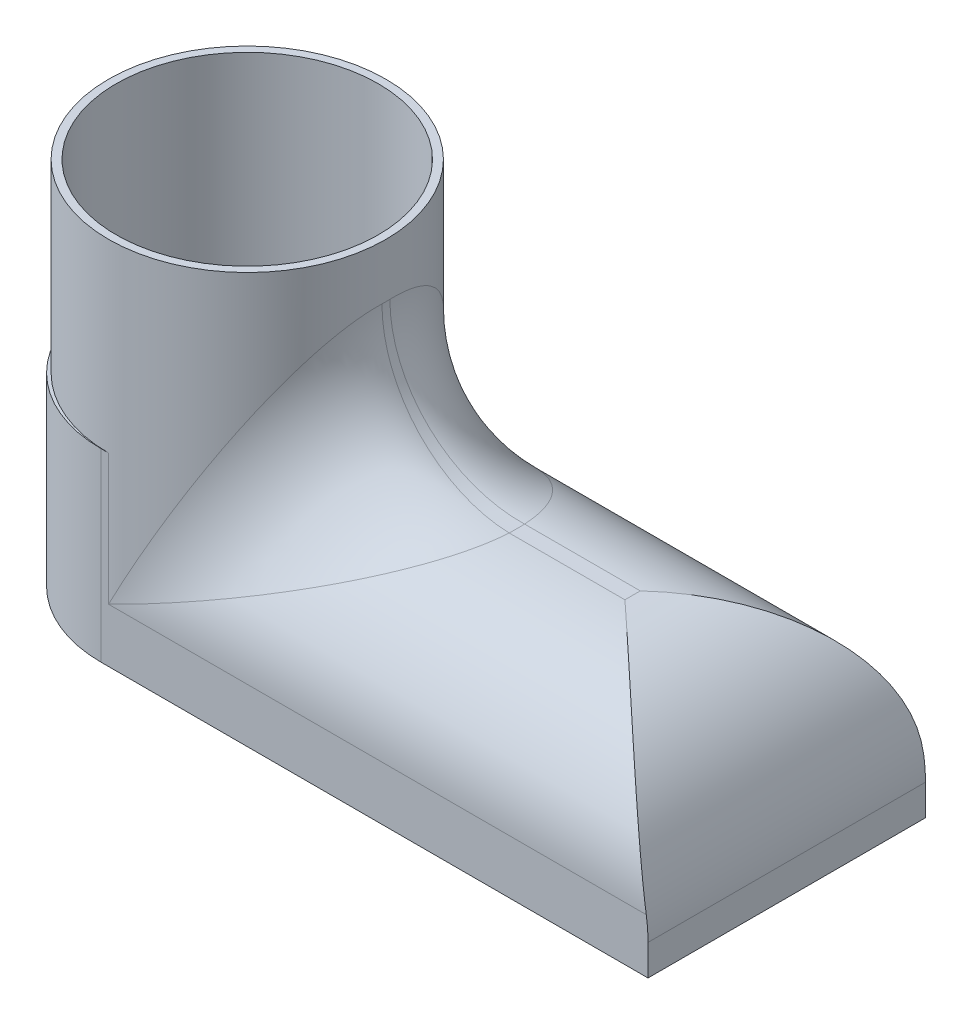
SolidWorks part; units mm, degrees
ref_plane "Front Plane" through (0, 0, 0) normal (0, 0, 1) x (1, 0, 0)
ref_plane "Top Plane" through (0, 0, 0) normal (0, 1, 0) x (1, 0, 0)
ref_plane "Right Plane" through (0, 0, 0) normal (1, 0, 0) x (0, 0, -1)
sketch "Sketch1" plane through (0, 0, 0) normal (0, 1, 0) x (1, 0, 0)
  circle A0 centre (0, 0) radius 53.975
  circle A1 centre (0, 0) radius 57.15
  dimension "D1" = 107.95
  dimension "D2" = 3.175
extrude "Extrude1" add sketch "Sketch1" along normal blind 76.2
sketch "Sketch2" plane through (0, 0, 0) normal (0, -1, 0) x (1, 0, 0)
  line L1 (-57.15, 57.15) -> (222.25, 57.15)
  line L2 (-57.15, 57.15) -> (-57.15, -57.15)
  line L3 (-57.15, -57.15) -> (222.25, -57.15)
  line L4 (222.25, 57.15) -> (222.25, -57.15)
  circle A1 centre (0, 0) radius 57.15 construction
  dimension "D1" = 279.4
extrude "Extrude2" add sketch "Sketch2" along normal blind 76.2
fillet "Fillet4" radius 63.5 1 edges at (222.25, 0, 0)
fillet "Fillet6" radius 53.975 2 edges at (-57.15, -38.1, -57.15) (-57.15, -38.1, 57.15)
fillet "Fillet7" radius 53.975 2 edges at (79.375, 0, -57.15) (79.375, 0, 57.15)
fillet "Fillet8" radius 53.975 3 edges at (48.4488, -7.3181, 30.3123) (57.15, 0, 0) (48.4488, -7.3181, -30.3123)
